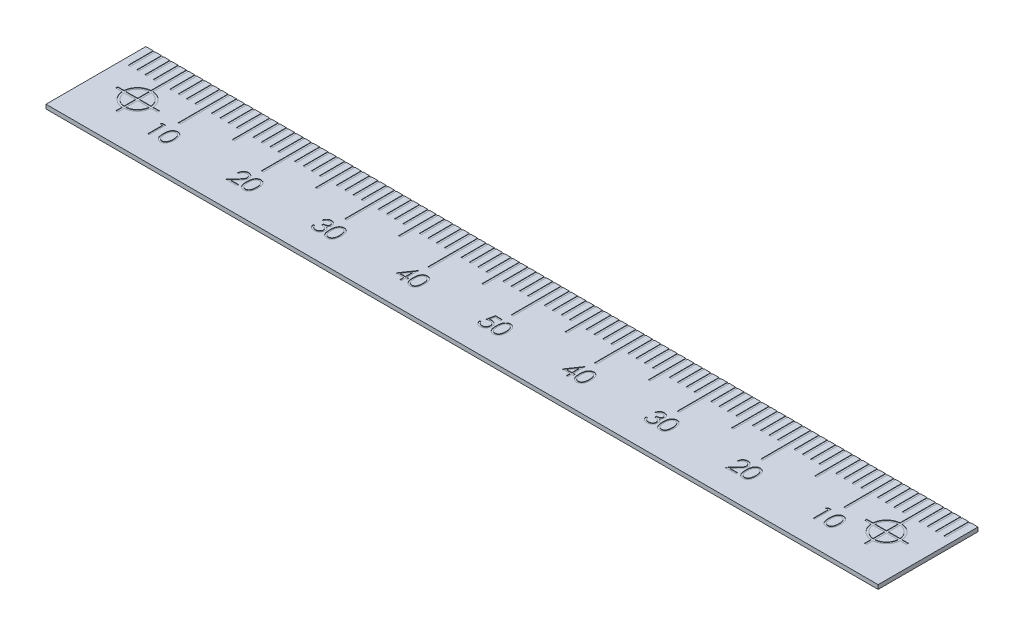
SolidWorks part; units mm, degrees
ref_plane "Front Plane" through (0, 0, 0) normal (0, 0, 1) x (1, 0, 0)
ref_plane "Top Plane" through (0, 0, 0) normal (0, 1, 0) x (1, 0, 0)
ref_plane "Right Plane" through (0, 0, 0) normal (1, 0, 0) x (0, 0, -1)
sketch "Sketch1" plane through (0, 0, 0) normal (0, 1, 0) x (1, 0, 0)
  line L1 (-50, 6) -> (50, 6)
  line L2 (-50, 6) -> (-50, -6)
  line L3 (-50, -6) -> (50, -6)
  line L4 (50, 6) -> (50, -6)
extrude "Boss-Extrude1" add sketch "Sketch1" against normal blind 0.5
sketch "Sketch2" plane through (0, 0, 0) normal (0, 1, 0) x (1, 0, 0)
  line L1 (-49.125, 3) -> (-48.875, 3)
  line L2 (-49.125, 3) -> (-49.125, 6)
  line L3 (-49.125, 6) -> (-48.875, 6)
  line L4 (-48.875, 3) -> (-48.875, 6)
  line L5 (-49, 6) -> (-49, 3) construction
  line L6 (-50, 6) -> (-50, -6) construction
  dimension "D1" = 3
  dimension "D2" = 0.25
  dimension "D3" = 1
extrude "Cut-Extrude2" cut sketch "Sketch2" against normal blind 0.05 contours L4 L3 L2 L1
pattern_linear "LPattern2" count 99 spacing 1 along (1, 0, 0) of "Cut-Extrude2"
sketch "Sketch3" plane through (0, 0, 0) normal (0, 1, 0) x (1, 0, 0)
  line L0 (-40.125, 3) -> (-40.125, 6) construction
  line L6 (-40.125, 3) -> (-39.875, 3)
  line L7 (-40.125, 3) -> (-40.125, 0)
  line L8 (-40.125, 0) -> (-39.875, 0)
  line L9 (-39.875, 3) -> (-39.875, 0)
  dimension "D1" = 0
  dimension "D2" = 0.25
  dimension "D4" = 3
extrude "Cut-Extrude3" cut sketch "Sketch3" against normal blind 0.05
pattern_linear "LPattern3" count 9 spacing 10 along (1, 0, 0) of "Cut-Extrude3"
sketch "Sketch4" plane through (0, 0, 0) normal (0, 1, 0) x (1, 0, 0)
  line L0 (-35.125, 3) -> (-35.125, 6) construction
  line L1 (-35.125, 3) -> (-34.875, 3)
  line L2 (-35.125, 3) -> (-35.125, 1.5)
  line L3 (-35.125, 1.5) -> (-34.875, 1.5)
  line L4 (-34.875, 3) -> (-34.875, 1.5)
  dimension "D1" = 0
  dimension "D2" = 0.25
  dimension "D3" = 3
  dimension "D4" = 1.5
extrude "Cut-Extrude4" cut sketch "Sketch4" against normal blind 0.05
pattern_linear "LPattern4" count 9 spacing 10 along (1, 0, 0) count 2 spacing 10 along (-1, 0, 0) of "Cut-Extrude4"
sketch "Sketch5" plane through (0, 0, 0) normal (0, 1, 0) x (1, 0, 0)
  line L0 (-44.995, 0) -> (-44.995, 2.5) construction
  line L1 (-44.995, 0) -> (-44.995, -2.5) construction
  line L2 (-44.995, 0) -> (-42.495, 0) construction
  line L3 (-44.995, 0) -> (-47.495, 0) construction
  line L5 (-45.12, 2.5) -> (-44.87, 2.5)
  line L6 (-45.12, 2.5) -> (-45.12, 1.7455)
  line L7 (-45.12, -2.5) -> (-44.87, -2.5)
  line L8 (-44.87, 2.5) -> (-44.87, 1.7455)
  line L9 (-47.495, 0.125) -> (-46.7405, 0.125)
  line L10 (-47.495, 0.125) -> (-47.495, -0.125)
  line L11 (-47.495, -0.125) -> (-46.7405, -0.125)
  line L12 (-42.495, 0.125) -> (-42.495, -0.125)
  line L13 (-48.125, 6) -> (-48.875, 6) construction
  line L14 (-45.12, 1.4948) -> (-45.12, 0.125)
  line L15 (-44.87, 1.4948) -> (-44.87, 0.125)
  line L16 (-43.2495, 0.125) -> (-42.495, 0.125)
  line L17 (-43.2495, -0.125) -> (-42.495, -0.125)
  line L18 (-44.87, -1.7455) -> (-44.87, -2.5)
  line L19 (-45.12, -1.7455) -> (-45.12, -2.5)
  line L20 (-46.4898, -0.125) -> (-45.12, -0.125)
  line L21 (-46.4898, 0.125) -> (-45.12, 0.125)
  line L22 (-44.87, -0.125) -> (-44.87, -1.4948)
  line L23 (-44.87, 0.125) -> (-43.5002, 0.125)
  line L24 (-45.12, -0.125) -> (-45.12, -1.4948)
  line L25 (-44.87, -0.125) -> (-43.5002, -0.125)
  arc A0 (-45.12, 1.4948) -> (-46.4898, 0.125) centre (-44.995, 0) ccw
  arc A1 (-45.12, 1.7455) -> (-46.7405, 0.125) centre (-44.995, 0) ccw
  arc A2 (-43.5002, 0.125) -> (-44.87, 1.4948) centre (-44.995, 0) ccw
  arc A3 (-43.2495, 0.125) -> (-44.87, 1.7455) centre (-44.995, 0) ccw
  arc A4 (-44.87, -1.4948) -> (-43.5002, -0.125) centre (-44.995, 0) ccw
  arc A5 (-44.87, -1.7455) -> (-43.2495, -0.125) centre (-44.995, 0) ccw
  arc A6 (-46.4898, -0.125) -> (-45.12, -1.4948) centre (-44.995, 0) ccw
  arc A7 (-46.7405, -0.125) -> (-45.12, -1.7455) centre (-44.995, 0) ccw
  point P34 (-44.995, 2.5)
extrude "Cut-Extrude6" cut sketch "Sketch5" against normal blind 0.05
pattern_linear "LPattern5" count 2 spacing 90 along (1, 0, 0) of "Cut-Extrude6"
sketch "Sketch7" plane through (0, 0, 0) normal (0, 1, 0) x (1, 0, 0)
  line L0 (-50, -6) -> (50, -6) construction
  line L1 (-50, 6) -> (-50, -6) construction
  text T0 "10         20         30         40" font "Century Gothic" height 2
  dimension "D1" = 3
  dimension "D2" = 8.5
extrude "Cut-Extrude7" cut sketch "Sketch7" against normal blind 0.05
sketch "Sketch11" plane through (0, 0, 0) normal (0, 1, 0) x (1, 0, 0)
  line L0 (-50, -6) -> (50, -6) construction
  line L1 (-50, 6) -> (-50, -6) construction
  text T0 "50         60         70         80         90" font "Century Gothic" height 2
  dimension "D1" = 3
  dimension "D2" = 48.5
extrude "Cut-Extrude8" [suppressed] cut sketch "Sketch11" against normal blind 0.05
sketch "Sketch14" plane through (0, 0, 0) normal (0, 1, 0) x (1, 0, 0)
  line L0 (-50, -6) -> (50, -6) construction
  line L1 (-50, 6) -> (-50, -6) construction
  text T0 "100       110       120       130       140" font "Century Gothic" height 2
  dimension "D1" = 3
  dimension "D2" = 97.5
extrude "Cut-Extrude10" [suppressed] cut sketch "Sketch14" against normal blind 0.05
sketch "Sketch15" plane through (0, 0, 0) normal (0, 1, 0) x (1, 0, 0)
  line L0 (-50, 6) -> (-50, -6) construction
  line L1 (-50, -6) -> (50, -6) construction
  text T0 "40         30         20         10" font "Century Gothic" height 2
  dimension "D1" = 108.5
  dimension "D2" = 3
extrude "Cut-Extrude12" [suppressed] cut sketch "Sketch15" against normal blind 0.05
sketch "Sketch18" plane through (0, 0, 0) normal (0, 1, 0) x (1, 0, 0)
  line L0 (-50, -6) -> (50, -6) construction
  line L1 (-50, 6) -> (-50, -6) construction
  text T0 "90         80         70         60         50" font "Century Gothic" height 2
  dimension "D1" = 3
  dimension "D2" = 8.5
extrude "Cut-Extrude13" [suppressed] cut sketch "Sketch18" against normal blind 0.05
sketch "Sketch19" plane through (0, 0, 0) normal (0, 1, 0) x (1, 0, 0)
  line L0 (-50, 6) -> (-50, -6) construction
  line L1 (-50, -6) -> (50, -6) construction
  text T0 "140       130       120       110       100" font "Century Gothic" height 2
  dimension "D1" = 7.5
  dimension "D2" = 3
extrude "Cut-Extrude14" [suppressed] cut sketch "Sketch19" against normal blind 0.05
sketch "Sketch20" plane through (0, 0, 0) normal (0, 1, 0) x (1, 0, 0)
  circle A0 centre (-44.995, 0) radius 1.75
extrude "Cut-Extrude15" [suppressed] cut sketch "Sketch20" against normal blind 0.5
pattern_linear "LPattern6" [suppressed] count 2 spacing 90
sketch "Sketch21" plane through (0, 0, 0) normal (0, 1, 0) x (1, 0, 0)
  line L0 (-50, -6) -> (50, -6) construction
  line L1 (-50, 6) -> (-50, -6) construction
  text T0 "10         20         30         40         50         40         30         20         10" font "Century Gothic" height 2
  dimension "D1" = 3
  dimension "D2" = 8.5
extrude "Cut-Extrude17" cut sketch "Sketch21" against normal blind 0.05
sketch "Sketch22" plane through (0, 0, 0) normal (0, 1, 0) x (1, 0, 0)
  line L0 (-50, -6) -> (50, -6) construction
  line L1 (-50, 6) -> (-50, -6) construction
  text T0 "10         20         30         40         50         60         70         80         90        100        90         80         70         60         50         40         30         20         10" font "Century Gothic" height 2
  dimension "D1" = 3
  dimension "D2" = 8.5
extrude "Cut-Extrude18" [suppressed] cut sketch "Sketch22" against normal blind 0.05
sketch "Sketch23" plane through (0, 0, 0) normal (0, 1, 0) x (1, 0, 0)
  line L0 (-50, -6) -> (50, -6) construction
  line L2 (-50, 6) -> (-50, -6) construction
  text T0 "10         20         30         40         50         60         70         80         90        100       110       120       130       140       150       160       170       180       190       20" font "Century Gothic" height 2
  dimension "D1" = 3
  dimension "D2" = 8.5
extrude "Cut-Extrude19" [suppressed] cut sketch "Sketch23" against normal blind 0.05
sketch "Sketch24" plane through (0, 0, 0) normal (0, 1, 0) x (1, 0, 0)
  line L0 (-50, -6) -> (50, -6) construction
  line L1 (-50, 6) -> (-50, -6) construction
  text T0 "10         20         30         40         50         60         70         80         90        100       110       120       130       140       150       160       170       180       190" font "Century Gothic" height 2
  dimension "D1" = 3
  dimension "D2" = 8.5
extrude "Cut-Extrude20" [suppressed] cut sketch "Sketch24" against normal blind 0.05
sketch "Sketch26" plane through (0, 0, 0) normal (0, 1, 0) x (1, 0, 0)
  line L0 (-50, -6) -> (50, -6) construction
  line L1 (-50, 6) -> (-50, -6) construction
  text T0 "190       180       170       160       150       140       130       120       110       100        90         80         70         60         50         40         30         20         10" font "Century Gothic" height 2
  dimension "D1" = 3
  dimension "D2" = 7.5
extrude "Cut-Extrude21" [suppressed] cut sketch "Sketch26" against normal blind 0.05
sketch "Sketch27" plane through (0, 0, 0) normal (0, 1, 0) x (1, 0, 0)
  line L0 (-50, -6) -> (50, -6) construction
  line L1 (-50, 6) -> (-50, -6) construction
  text T0 "490       480       470       460       450       440       430       420       410       400       390       380       370       360       350       340       330       320       310       300       " font "Century Gothic" height 2
  dimension "D1" = 3
  dimension "D2" = 7.5
extrude "Cut-Extrude22" [suppressed] cut sketch "Sketch27" against normal blind 0.05
sketch "Sketch29" plane through (0, 0, 0) normal (0, 1, 0) x (1, 0, 0)
  line L0 (-50, -6) -> (50, -6) construction
  line L1 (-50, 6) -> (-50, -6) construction
  text T0 "10         20         30         40         50         60         70         80         90        100       110       120       130       140       150       160       170       180       190       20" font "Century Gothic" height 2
  dimension "D1" = 3
  dimension "D2" = 8.5
extrude "Cut-Extrude23" [suppressed] cut sketch "Sketch29" against normal blind 0.05
sketch "Sketch30" plane through (0, 0, 0) normal (0, 1, 0) x (1, 0, 0)
  line L0 (-50, -6) -> (50, -6) construction
  line L1 (-50, 6) -> (-50, -6) construction
  text T0 "240       230       220       210       200       190       180       170       160       150       140       130       120       110       100        90         80         70         60         50   " font "Century Gothic" height 2
  dimension "D1" = 3
  dimension "D2" = 7.5
extrude "Cut-Extrude24" [suppressed] cut sketch "Sketch30" against normal blind 0.05
sketch "Sketch31" [suppressed] plane through (0, 0, 0) normal (0, 1, 0) x (1, 0, 0)
  line L0 (-100, -6) -> (100, -6) construction
  line L1 (-100, 6) -> (-100, -6) construction
  text T0 "150       160       170       180       190" font "Century Gothic" height 2
  dimension "D1" = 3
  dimension "D2" = 148.5
extrude "Cut-Extrude25" [suppressed] cut sketch "Sketch31" against normal blind 0.05
sketch "Sketch32" [suppressed] plane through (0, 0, 0) normal (0, 1, 0) x (1, 0, 0)
  line L0 (-25, -6) -> (25, -6) construction
  line L1 (-24.125, -6) -> (-23.875, -6)
  line L2 (-24.125, -6) -> (-24.125, -3)
  line L3 (-24.125, -3) -> (-23.875, -3)
  line L4 (-23.875, -6) -> (-23.875, -3)
  line L5 (-24, -3) -> (-24, -6) construction
  line L6 (-25, 6) -> (-25, -6) construction
  dimension "D1" = 0.25
  dimension "D2" = 3
  dimension "D3" = 1
extrude "Cut-Extrude26" [suppressed] cut sketch "Sketch32" against normal blind 0.05
pattern_linear "LPattern7" [suppressed] count 99 spacing 1
sketch "Sketch34" [suppressed] plane through (0, 0, 0) normal (0, 1, 0) x (1, 0, 0)
  line L1 (-245.125, -3) -> (-244.875, -3)
  line L2 (-245.125, -3) -> (-245.125, -1.5)
  line L3 (-245.125, -1.5) -> (-244.875, -1.5)
  line L4 (-244.875, -3) -> (-244.875, -1.5)
  dimension "D1" = 1.5
  dimension "D2" = 0.25
extrude "Cut-Extrude27" [suppressed] cut sketch "Sketch34" against normal blind 0.05
pattern_linear "LPattern8" [suppressed] count 4 spacing 10
sketch "Sketch35" [suppressed] plane through (0, 0, 0) normal (0, 1, 0) x (1, 0, 0)
  line L1 (-240.125, -3) -> (-239.875, -3)
  line L2 (-240.125, -3) -> (-240.125, 0)
  line L3 (-240.125, 0) -> (-239.875, 0)
  line L4 (-239.875, -3) -> (-239.875, 0)
  dimension "D1" = 3
  dimension "D2" = 0.25
extrude "Cut-Extrude28" [suppressed] cut sketch "Sketch35" against normal blind 0.05
pattern_linear "LPattern9" [suppressed] count 4 spacing 10
equation "\"D2@Sketch1\"=\"D1@Sketch1\"/2"
equation "\"D4@Sketch1\"=\"D3@Sketch1\"/2"
equation "\"D8@Sketch5\"=\"D7@Sketch5\"/2"
equation "\"D10@Sketch5\"=\"D9@Sketch5\"/2"
